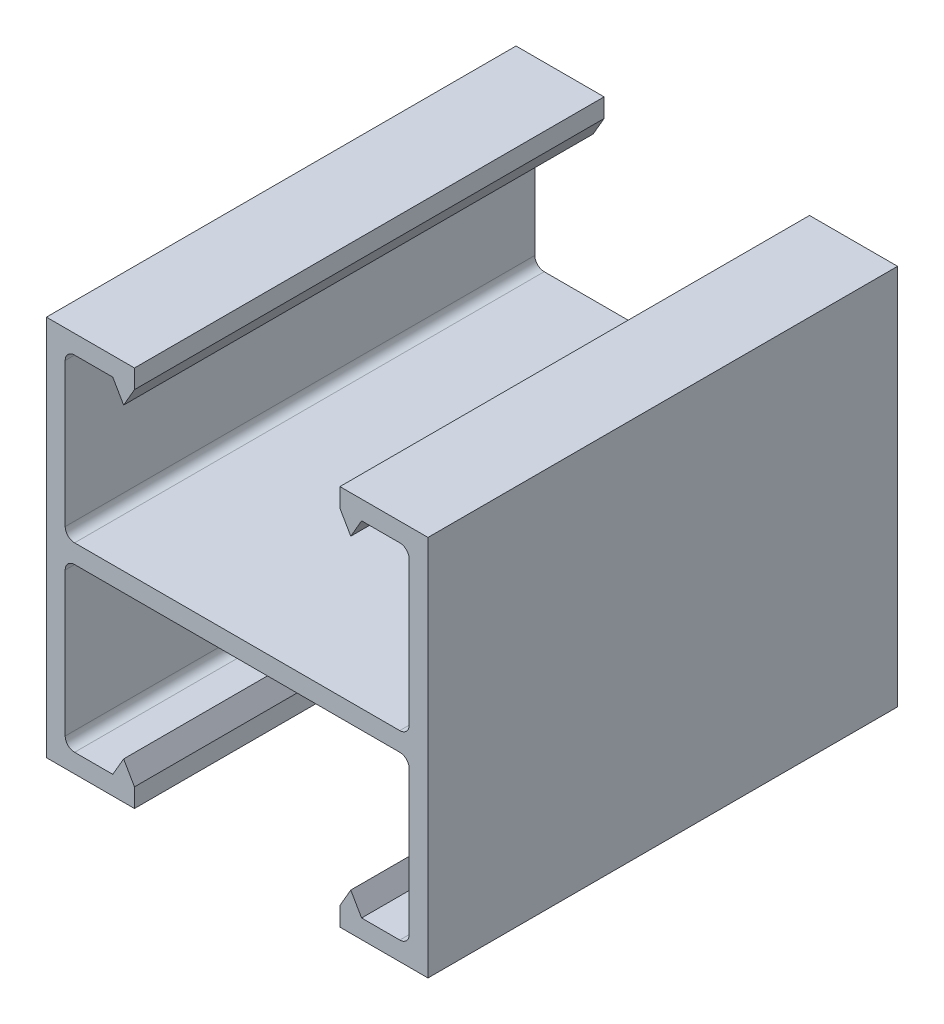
SolidWorks part; units mm, degrees
ref_plane "Plane1" through (0, 0, 0) normal (0, 0, 1) x (1, 0, 0)
ref_plane "Plane2" through (0, 0, 0) normal (0, 1, 0) x (1, 0, 0)
ref_plane "Plane3" through (0, 0, 0) normal (1, 0, 0) x (0, 0, -1)
sketch "Sketch1" plane through (0, 0, 0) normal (0, 0, 1) x (1, 0, 0)
  line L0 (-5.5563, 10.3188) -> (-10.3187, 10.3188)
  line L1 (-10.3187, 10.3188) -> (-10.3187, -10.3188)
  line L2 (-6.7294, -9.3028) -> (-8.7948, -9.3027)
  line L3 (10.3188, -10.3187) -> (10.3188, 10.3188)
  line L4 (10.3188, 10.3188) -> (5.5562, 10.3188)
  line L5 (8.7948, 9.3028) -> (6.7294, 9.3028)
  line L6 (9.3028, 1.016) -> (9.3028, 8.7948)
  line L7 (-8.7947, 0.508) -> (8.7948, 0.508)
  line L8 (-9.3027, 8.7948) -> (-9.3027, 1.016)
  line L9 (-6.7294, 9.3028) -> (-8.7948, 9.3027)
  line L10 (6.7294, 9.3028) -> (6.1428, 8.2868)
  line L11 (6.1428, 8.2868) -> (5.5562, 9.3028)
  line L12 (5.5562, 9.3028) -> (5.5562, 10.3188)
  line L13 (-6.7294, 9.3028) -> (-6.1428, 8.2868)
  line L14 (-6.1428, 8.2868) -> (-5.5563, 9.3028)
  line L15 (-5.5563, 9.3028) -> (-5.5563, 10.3188)
  line L16 (22.86, 0) -> (-25.4, 0) construction
  line L17 (6.1428, -8.2867) -> (5.5562, -9.3027)
  line L18 (6.7294, -9.3027) -> (6.1428, -8.2867)
  line L19 (8.7948, -9.3027) -> (6.7294, -9.3027)
  line L20 (10.3188, -10.3187) -> (5.5562, -10.3187)
  line L21 (5.5562, -9.3027) -> (5.5562, -10.3187)
  line L22 (-5.5562, -10.3188) -> (-10.3187, -10.3188)
  line L23 (-5.5562, -9.3028) -> (-5.5562, -10.3188)
  line L24 (-6.1428, -8.2868) -> (-5.5562, -9.3028)
  line L25 (-6.7294, -9.3028) -> (-6.1428, -8.2868)
  line L26 (-9.3027, -8.7948) -> (-9.3027, -1.016)
  line L27 (9.3028, -1.016) -> (9.3028, -8.7947)
  line L28 (-8.7947, -0.508) -> (8.7948, -0.508)
  arc A0 (-9.3027, 1.016) -> (-8.7947, 0.508) centre (-8.7947, 1.016) ccw
  arc A1 (-8.7948, 9.3027) -> (-9.3027, 8.7948) centre (-8.7948, 8.7948) ccw
  arc A2 (9.3028, 8.7948) -> (8.7948, 9.3028) centre (8.7948, 8.7948) ccw
  arc A3 (8.7948, 0.508) -> (9.3028, 1.016) centre (8.7948, 1.016) ccw
  arc A4 (9.3028, -8.7947) -> (8.7948, -9.3027) centre (8.7948, -8.7947) cw
  arc A5 (-8.7948, -9.3027) -> (-9.3027, -8.7948) centre (-8.7948, -8.7948) cw
  arc A6 (8.7948, -0.508) -> (9.3028, -1.016) centre (8.7948, -1.016) cw
  arc A7 (-9.3027, -1.016) -> (-8.7947, -0.508) centre (-8.7947, -1.016) cw
  dimension "D5" = 0.508
  dimension "D3" = 10.3187
  dimension "D4" = 60
  dimension "Width" = 20.6375
  dimension "Height" = 20.6375
  dimension "D8" = 10.3187
  dimension "D10" = 11.1125
  dimension "edge" = 4.7625
  dimension "D13" = 0.5866
extrude "Base-Extrude" add sketch "Sketch1" along normal mid plane 25.4
equation "\"D8@Sketch1\" = \"Width@Sketch1\" / 2"
equation "\"D10@Sketch1\" = \"Width@Sketch1\" - 2 * \"edge@Sketch1\""
equation "\"D5@Sketch1\" = \"gauge@Sketch1\" / 2"
equation "\"D3@Sketch1\" = \"Height@Sketch1\" / 2"
equation "\"D13@Sketch1\" = \"gauge@Sketch1\" * .577350269"
